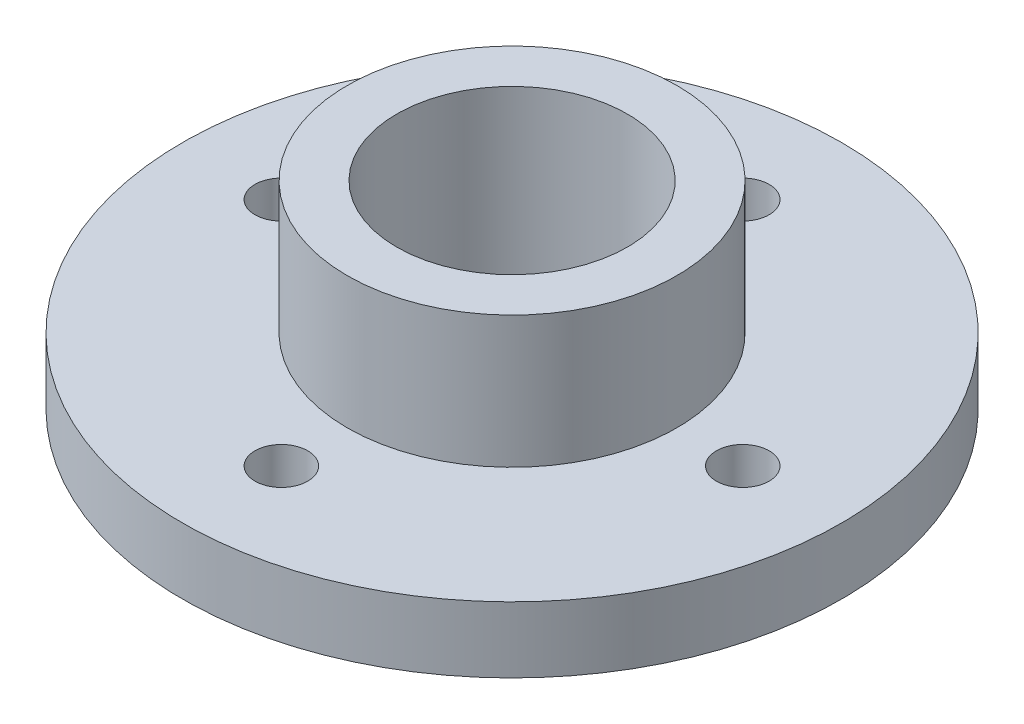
SolidWorks part; units mm, degrees
ref_plane "前视基准面" through (0, 0, 0) normal (0, 0, 1) x (1, 0, 0)
ref_plane "上视基准面" through (0, 0, 0) normal (0, 1, 0) x (1, 0, 0)
ref_plane "右视基准面" through (0, 0, 0) normal (1, 0, 0) x (0, 0, -1)
other "Configuration Table"
sketch "草图1" plane through (0, 0, 0) normal (0, 0, 1) x (1, 0, 0)
  line L0 (0, 0) -> (10, 0)
  line L1 (0, 0) -> (0, 7)
  line L2 (0, 7) -> (3.5, 7)
  line L3 (3.5, 7) -> (3.5, 6)
  line L4 (3.5, 6) -> (5, 6)
  line L5 (5, 6) -> (5, 2)
  line L6 (5, 2) -> (10, 2)
  line L7 (10, 2) -> (10, 0)
  dimension "D1" = 10
  dimension "D2" = 2
  dimension "D3" = 4
  dimension "D4" = 1
  dimension "D5" = 5
  dimension "D6" = 3.5
revolve "旋转1" add sketch "草图1" angle 360 about L1
hole_wizard "M2 螺纹孔1" positions "草图2" profile "草图3" tap size "M2" standard "GB"
sketch "草图2" plane through (0, 2, 0) normal (0, 1, 0) x (1, 0, 0)
  point P0 (0, 7)
  point P2 (0, -7)
  point P4 (7, 0)
  point P6 (-7, 0)
  dimension "D1" = 7
  dimension "D2" = 7
  dimension "D3" = 7
  dimension "D4" = 7
sketch "草图3" plane through (0, 2, -7) normal (1, 0, 0) x (0, 0, 1)
  line L0 (0, 0) -> (0, 5.6807)
  line L1 (0, 5.6807) -> (0.8, 5.2)
  line L2 (0.8, 5.2) -> (0.8, 0)
  line L5 (0.8, 0) -> (0, 0)
  line L10 (0, 5.6807) -> (-0.8, 5.2) construction
  line L11 (0, -6.35) -> (0, 107.95) construction
  dimension "螺纹孔钻头直径" = 1.6
  dimension "螺纹孔钻头深度" = 5.2
  dimension "导头角度" = 118
sketch "草图4" plane through (0, 7, 0) normal (0, 1, 0) x (1, 0, 0)
  circle A0 centre (0, 0) radius 3.5
extrude "切除-拉伸1" cut sketch "草图4" against normal through all
